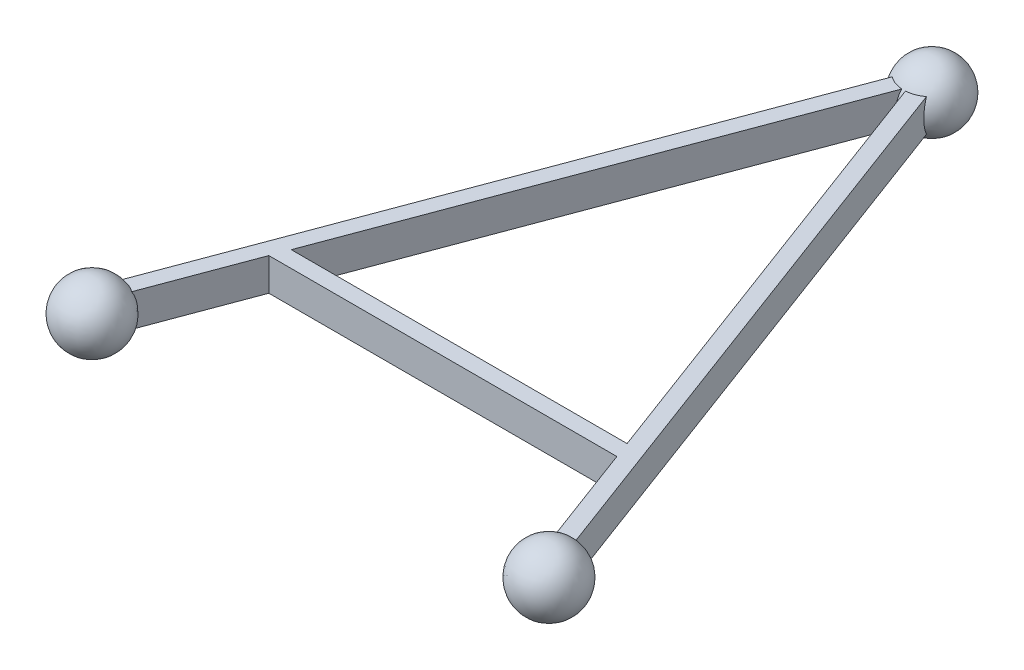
SolidWorks part; units mm, degrees
ref_plane "Front Plane" through (0, 0, 0) normal (0, 0, 1) x (1, 0, 0)
ref_plane "Top Plane" through (0, 0, 0) normal (0, 1, 0) x (1, 0, 0)
ref_plane "Right Plane" through (0, 0, 0) normal (1, 0, 0) x (0, 0, -1)
sketch "Sketch2" plane through (0, 0, 0) normal (0, 1, 0) x (1, 0, 0)
  line L0 (0, 0) -> (-88.9, 237.9344)
  line L1 (-88.9, 237.9344) -> (-177.8, 0)
  line L2 (-177.8, 0) -> (0, 0)
  line L3 (-158.8195, 50.8) -> (-18.9805, 50.8)
  dimension "D1" = 254
  dimension "D2" = 177.8
  dimension "D3" = 50.8
sketch "Sketch3" plane through (0, 0, 0) normal (0, 0, 1) x (1, 0, 0)
  line L0 (-177.8, 19.0817) -> (-177.8, -19.0817) construction
  line L1 (-177.8, 12.7) -> (-177.8, -12.7)
  arc A0 (-177.8, -12.7) -> (-177.8, 12.7) centre (-177.8, 0) ccw
  dimension "D1" = 25.4
revolve "Revolve1" add sketch "Sketch3" angle 360 about L0
sketch "Sketch4" plane through (0, 0, 0) normal (0, 0, 1) x (1, 0, 0)
  line L0 (0, 22.7949) -> (0, -23.105) construction
  line L1 (0, 12.7) -> (0, -12.7)
  arc A0 (0, 12.7) -> (0, -12.7) centre (0, 0) ccw
  dimension "D1" = 25.4
revolve "Revolve2" add sketch "Sketch4" angle 360 about L0
sketch "Sketch6" plane through (0, 0, 0) normal (0, 0, 1) x (1, 0, 0)
  line L0 (0, 0) -> (0, 50.0726) construction
ref_plane "Plane1" through (0, 0, 0) normal (0.9367, 0, -0.35) x (-0.35, 0, -0.9367)
sketch "Sketch7" plane through (0, 0, 0) normal (0.9367, 0, -0.35) x (-0.35, 0, -0.9367)
  line L0 (254, -33.2408) -> (254, 33.2408) construction
  line L1 (254, 12.7) -> (254, -12.7)
  arc A0 (254, 12.7) -> (254, -12.7) centre (254, 0) ccw
  dimension "D1" = 25.4
revolve "Revolve3" add sketch "Sketch7" angle 360 about L0
ref_plane "Plane2" through (-177.8, 0, 0) normal (-0.35, 0, 0.9367) x (0.9367, 0, 0.35)
sketch "Sketch8" plane through (-177.8, 0, 0) normal (-0.35, 0, 0.9367) x (0.9367, 0, 0.35)
  line L0 (-3.175, 6.35) -> (3.175, -6.35) construction
  line L1 (-3.175, 6.35) -> (3.175, 6.35)
  line L2 (-3.175, 6.35) -> (-3.175, -6.35)
  line L3 (-3.175, -6.35) -> (3.175, -6.35)
  line L4 (3.175, 6.35) -> (3.175, -6.35)
  dimension "D1" = 12.7
  dimension "D2" = 6.35
extrude "Extrude3" add sketch "Sketch8" against normal up to surface (243.4697 mm away)
ref_plane "Plane3" through (0, 0, 0) normal (-0.35, 0, -0.9367) x (-0.9367, 0, 0.35)
sketch "Sketch9" plane through (0, 0, 0) normal (-0.35, 0, -0.9367) x (-0.9367, 0, 0.35)
  line L0 (3.175, 6.35) -> (-3.175, -6.35) construction
  line L1 (3.175, 6.35) -> (-3.175, 6.35)
  line L2 (3.175, 6.35) -> (3.175, -6.35)
  line L3 (3.175, -6.35) -> (-3.175, -6.35)
  line L4 (-3.175, 6.35) -> (-3.175, -6.35)
  dimension "D1" = 6.35
  dimension "D2" = 12.7
extrude "Extrude4" add sketch "Sketch9" along normal up to surface (243.4697 mm away)
ref_plane "Plane4" through (-18.9805, 0, -50.8) normal (1, 0, 0) x (0, 0, -1)
sketch "Sketch10" plane through (-18.9805, 0, -50.8) normal (1, 0, 0) x (0, 0, -1)
  line L0 (-3.175, 6.35) -> (3.175, -6.35) construction
  line L1 (-3.175, 6.35) -> (3.175, 6.35)
  line L2 (-3.175, 6.35) -> (-3.175, -6.35)
  line L3 (-3.175, -6.35) -> (3.175, -6.35)
  line L4 (3.175, 6.35) -> (3.175, -6.35)
  dimension "D1" = 12.7
  dimension "D2" = 6.35
extrude "Extrude5" add sketch "Sketch10" against normal up to surface (135.2633 mm away)
sketch3d "3DSketch1"
  point P0 (-177.8, 0, 0)
  point P1 (0, 0, 0)
